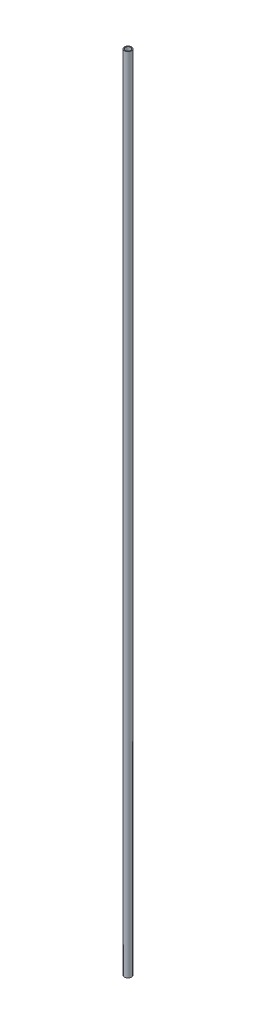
SolidWorks part; units mm, degrees
ref_plane "Front Plane" through (0, 0, 0) normal (0, 0, 1) x (1, 0, 0)
ref_plane "Top Plane" through (0, 0, 0) normal (0, 1, 0) x (1, 0, 0)
ref_plane "Right Plane" through (0, 0, 0) normal (1, 0, 0) x (0, 0, -1)
sketch "Sketch1" plane through (0, 0, 0) normal (0, 1, 0) x (1, 0, 0)
  circle A0 centre (0, 0) radius 10.2108
  circle A1 centre (0, 0) radius 13.335
  dimension "D1" = 26.67
  dimension "D2" = 20.4216
extrude "Boss-Extrude1" add sketch "Sketch1" along normal blind 3048
